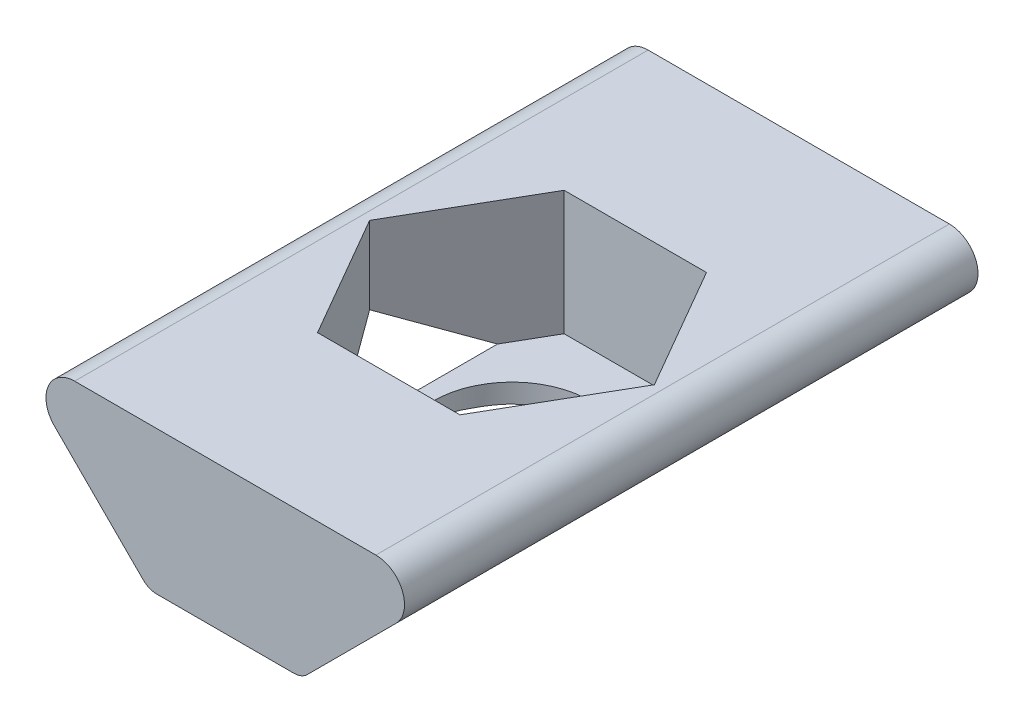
SolidWorks part; units mm, degrees
ref_plane "Alzado" through (0, 0, 0) normal (0, 0, 1) x (1, 0, 0)
ref_plane "Planta" through (0, 0, 0) normal (0, 1, 0) x (1, 0, 0)
ref_plane "Vista lateral" through (0, 0, 0) normal (1, 0, 0) x (0, 0, -1)
sketch "Croquis1" plane through (0, 0, 0) normal (0, 0, 1) x (1, 0, 0)
  line L6 (11.5, 3.75) -> (-11.5, 3.75)
  line L9 (0, -55) -> (0, 55) construction
  line L12 (-11.5, 3.75) -> (-4, -3.75)
  line L17 (-4, -3.75) -> (4, -3.75)
  line L18 (11.5, 3.75) -> (4, -3.75)
  point P2 (0, -3.75)
  point P3 (0, 3.75)
  dimension "D1" = 11.5
  dimension "D2" = 4
  dimension "D3" = 135
  dimension "D4" = 3.75
  dimension "D5" = 7.5
extrude "Saliente-Extruir1" add sketch "Croquis1" along normal mid plane 30
fillet "Redondeo1" radius 1.5 2 edges at (11.5, 3.75, 0) (-11.5, 3.75, 0)
fillet "Redondeo2" radius 1 2 edges at (4, -3.75, 0) (-4, -3.75, 0)
sketch "Croquis2" plane through (0, 3.75, 0) normal (0, 1, 0) x (1, 0, 0)
  line L1 (7.4478, 0) -> (3.7239, 6.45)
  line L2 (3.7239, 6.45) -> (-3.7239, 6.45)
  line L3 (-3.7239, 6.45) -> (-7.4478, 0)
  line L4 (-7.4478, 0) -> (-3.7239, -6.45)
  line L5 (-3.7239, -6.45) -> (3.7239, -6.45)
  line L6 (3.7239, -6.45) -> (7.4478, 0)
  circle A0 centre (0, 0) radius 6.45 construction
  point P1 (0, 0)
  dimension "D1" = 12.9
extrude "Cortar-Extruir1" cut sketch "Croquis2" against normal blind 6.5
sketch "Croquis3" plane through (0, -2.75, 0) normal (0, 1, 0) x (1, 0, 0)
  circle A0 centre (0, 0) radius 4.1
  dimension "D1" = 8.2
extrude "Cortar-Extruir2" cut sketch "Croquis3" against normal through all contours A0
